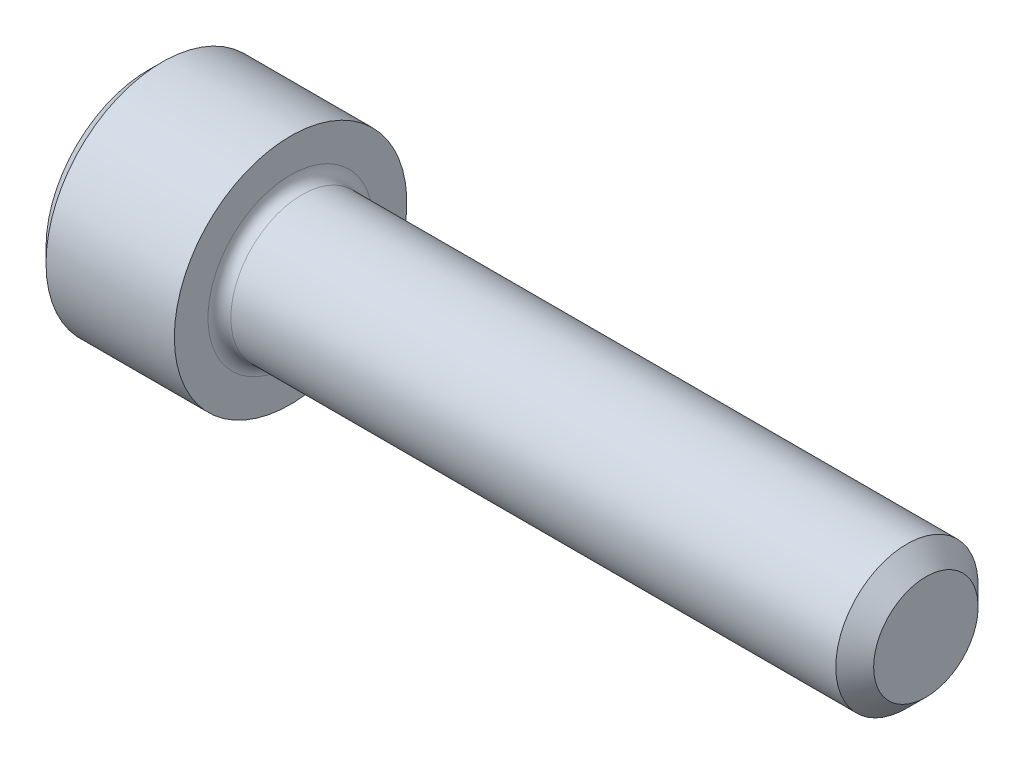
SolidWorks part; units mm, degrees
ref_plane "Plane1" through (0, 0, 0) normal (0, 0, 1) x (1, 0, 0)
ref_plane "Plane2" through (0, 0, 0) normal (0, 1, 0) x (1, 0, 0)
ref_plane "Plane3" through (0, 0, 0) normal (1, 0, 0) x (0, 0, -1)
sketch "BodySke" plane through (0, 0, 0) normal (0, 0, 1) x (1, 0, 0)
  line L0 (0, 0) -> (0, 2.0447)
  line L1 (0.2794, 2.3241) -> (2.8448, 2.3241)
  line L2 (2.8448, 2.3241) -> (2.8448, 1.4224)
  line L3 (2.8448, 1.4224) -> (15.1663, 1.4224)
  line L4 (15.5448, 1.0439) -> (15.5448, 0)
  line L5 (15.5448, 0) -> (0, 0)
  line L6 (-31.75, 0) -> (127, 0) construction
  line L7 (0, 2.0447) -> (0.2794, 2.3241)
  line L8 (15.5448, 1.0439) -> (15.1663, 1.4224)
  line L9 (0, -2.0447) -> (0.2794, -2.3241) construction
  line L10 (15.5448, -1.0439) -> (15.1663, -1.4224) construction
  line L11 (3.4798, 9.525) -> (3.4798, 3.175) construction
  line L12 (2.8448, 9.525) -> (2.8448, 3.175) construction
  line L13 (-22.5552, 9.525) -> (-22.5552, 3.175) construction
  dimension "Diameter" = 2.8448
  dimension "Head_ht" = 2.8448
  dimension "Length" = 12.7
  dimension "Body_ch_ang" = 45
  dimension "Head_dia" = 4.6482
  dimension "Head_ch_ang" = 45
  dimension "Head_side_ht" = 2.5654
  dimension "Minor_dia" = 2.0879
  dimension "Advance" = 0.635
  dimension "Thread_nom" = 12.7
  dimension "Thread_length" = 38.1
revolve "Base-Revolve" add sketch "BodySke"
fillet "Fillet1" radius 0.2286
sketch "Sketch2" plane through (0, 0, 0) normal (0, 0, 1) x (1, 0, 0)
  line L0 (0, 1.1938) -> (1.2954, 1.1938)
  line L1 (1.2954, 1.1938) -> (1.9846, 0)
  line L2 (-31.75, 0) -> (127, 0) construction
  line L3 (1.9846, 0) -> (0, 0)
  line L4 (0, 0) -> (0, 1.1938)
  line L5 (0, 2.0447) -> (0, -2.0447) construction
  line L6 (0, 0) -> (47.625, 0) construction
  line L7 (2.8448, -2.3241) -> (2.8448, 2.3241) construction
  dimension "D1" = 1.1938
  dimension "D2" = 60
  dimension "Wall_thickness" = 1.5494
revolve "Hex-PreBroach" cut sketch "Sketch2" angle 360 about L6
sketch "Sketch3" plane through (0, 0, 0) normal (-1, 0, 0) x (0, 0.5, 0.866)
  line L0 (0.6892, 1.1938) -> (-0.6892, 1.1938)
  line L1 (-0.6892, 1.1938) -> (-1.3785, 0)
  line L2 (0.6892, 1.1938) -> (1.3785, 0)
  line L3 (0.6892, -1.1938) -> (1.3785, 0)
  line L4 (0.6892, -1.1938) -> (-0.6892, -1.1938)
  line L5 (-0.6892, -1.1938) -> (-1.3785, 0)
  dimension "D1" = 1.1938
  dimension "D2" = 1.1938
  dimension "Hex_size" = 2.3876
extrude "Hex" cut sketch "Sketch3" against normal blind 1.2954
sketch "Sketch4" plane through (0, 0, 0) normal (-1, 0, 0) x (0, 0, 1)
  line L0 (0, 0) -> (1.4605, 0)
  line L1 (0, 0) -> (6.1484, 3.5498) construction
  line L2 (0, 0) -> (0.7302, 1.2648)
  line L3 (1.2009, 0.3267) -> (1.3933, 0.4378)
  line L4 (0.8834, 0.8767) -> (1.0758, 0.9877)
  arc A0 (1.2009, 0.3267) -> (0.8834, 0.8767) centre (0, 0) ccw
  arc A1 (1.4605, 0) -> (1.3933, 0.4378) centre (0, 0) ccw
  arc A2 (0.7302, 1.2648) -> (1.0758, 0.9877) centre (0, 0) cw
  dimension "D1" = 30
  dimension "Spline_n_dim" = 2.4892
  dimension "Spline_m_dim" = 2.921
  dimension "D2" = 60
  dimension "D3" = 0.3175
  dimension "Spline_p_dim" = 0.635
extrude "Spline" [suppressed] cut sketch "Sketch4" against normal blind 1.2954
pattern_circular "CirPattern1" [suppressed] count 6 every 60
sketch "Sketch5" plane through (0, 0, 0) normal (0, 0, 1) x (1, 0, 0)
  line L0 (-31.75, 0) -> (127, 0) construction
  line L1 (0, -0.6892) -> (0, 0.6892) construction
  line L2 (0, 2.0447) -> (0, -2.0447) construction
  circle A0 centre (1.016, 0) radius 0.4445
  dimension "Drilled_hole_dia" = 0.889
  dimension "Drilled_hole_loc" = 1.016
extrude "Hole" [suppressed] cut sketch "Sketch5" against normal through all and the other way through all
pattern_circular "Drilled-4" [suppressed] count 2 every 60
pattern_circular "Drilled-6" [suppressed] count 3 every 60
sketch "ThdSchSke" plane through (0, 0, 0) normal (0, 0, 1) x (1, 0, 0)
  line L0 (3.4798, -1.0439) -> (3.2148, -1.4224)
  line L1 (3.4798, -1.0439) -> (3.7448, -1.4224)
  line L2 (3.7448, -1.4224) -> (3.7448, -1.778)
  line L3 (-3.175, 0) -> (5.1513, 0) construction
  line L5 (3.7448, -1.778) -> (3.2148, -1.778)
  line L6 (3.2148, -1.778) -> (3.2148, -1.4224)
  line L7 (0, 2.0447) -> (0, -2.0447) construction
  dimension "Thread_minor" = 2.0879
  dimension "Diameter" = 2.8448
  dimension "Start" = 3.4798
  dimension "SideAngle" = 55
  dimension "VeeAngle" = 70
  dimension "Overcut" = 3.556
revolve "ThreadSchematic" [suppressed] cut sketch "ThdSchSke" angle 360 about L3
pattern_linear "ThdSchPat" [suppressed]
equation "\"D2@Sketch3\" = \"Hex_size@Sketch3\" / 2"
equation "\"D1@Sketch3\" = \"Hex_size@Sketch3\" / 2"
equation "\"D1@Sketch2\" = \"Hex_size@Sketch3\" / 2"
equation "\"D3@Sketch4\" = \"Spline_p_dim@Sketch4\" / 2"
equation "\"Thread_minor@ThreadCosmetic\"  =  \"Minor_dia@BodySke\""
equation "\"D2@CirPattern1\" = 360 / \"Num_teeth@CirPattern1\""
equation "\"Wall_thickness@Sketch2\" = \"Head_ht@BodySke\" - \"Key_eng@Hex\""
equation "\"Thread_length@ThreadCosmetic\" = ((sgn( (\"Length@BodySke\" - \"Advance@BodySke\" ) - \"Thread_nom@BodySke\" )-1)*( (\"Length@BodySke\" - \"Advance@BodySke\" ) - \"Thread_nom@BodySke\" ))/-2+ \"Thread_nom@BodySke\""
equation "\"Thread_minor@ThdSchSke\" = \"Minor_dia@BodySke\""
equation "\"Diameter@ThdSchSke\" = \"Diameter@BodySke\""
equation "\"Overcut@ThdSchSke\" = \"Diameter@BodySke\" * 1.25"
equation "\"Start@ThdSchSke\" = \"Head_ht@BodySke\" + \"Length@BodySke\" - \"Thread_length@ThreadCosmetic\"  '---Non-countersunk---"
equation "\"Num_threads@ThdSchPat\" = int( \"Thread_length@ThreadCosmetic\" / \"Advance@BodySke\" + 0.999 )  + 1"
equation "\"Advance@ThdSchPat\" = \"Thread_length@ThreadCosmetic\" /  (\"Num_threads@ThdSchPat\" - 1) 'relax it"
equation "\"Num_threads@ThdSchPat\" = \"Num_threads@ThdSchPat\" - sgn( \"Num_threads@ThdSchPat\" - 1) '---chamfered tips only---"
